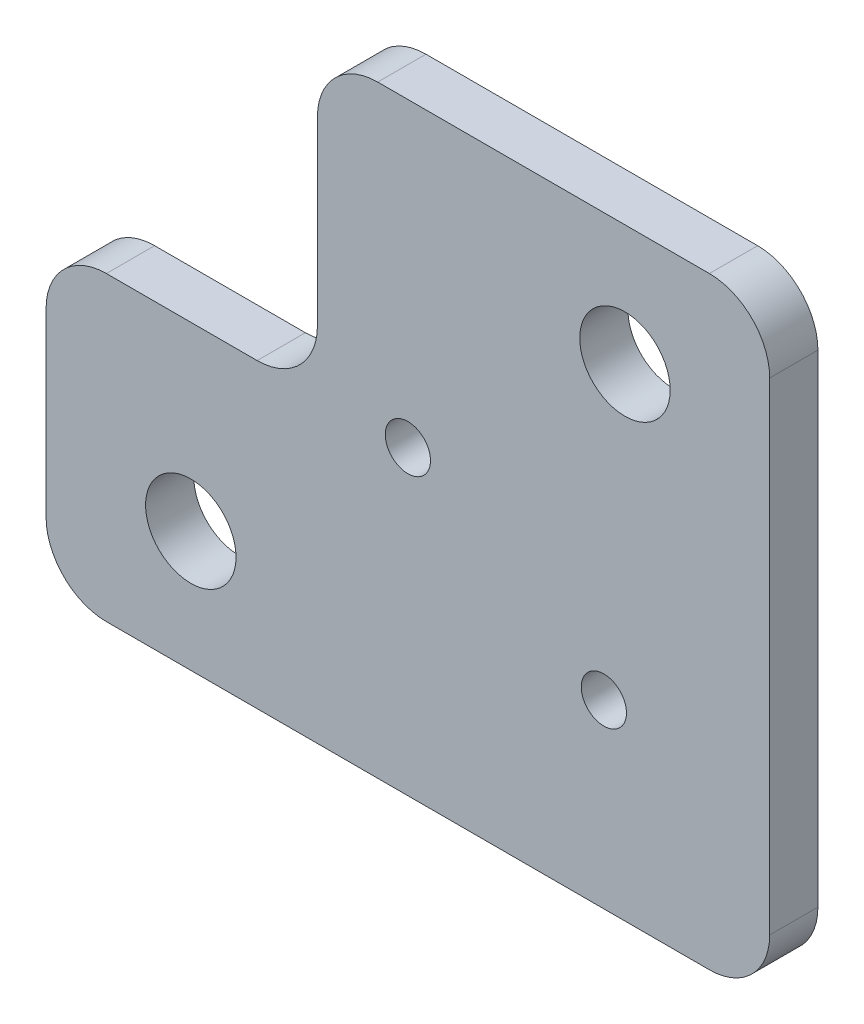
SolidWorks part; units mm, degrees
ref_plane "Спереди" through (0, 0, 0) normal (0, 0, 1) x (1, 0, 0)
ref_plane "Сверху" through (0, 0, 0) normal (0, 1, 0) x (1, 0, 0)
ref_plane "Справа" through (0, 0, 0) normal (1, 0, 0) x (0, 0, -1)
sketch "Эскиз1" plane through (0, 0, 0) normal (0, 0, 1) x (1, 0, 0)
  line L1 (-6, -5) -> (6, -5)
  line L2 (-6, -5) -> (-6, 5)
  line L3 (-6, 5) -> (6, 5)
  line L4 (6, -5) -> (6, 5)
  line L5 (-6, -5) -> (6, 5) construction
  line L6 (-6, 5) -> (6, -5) construction
  point P0 (0, 0)
  dimension "D1" = 12
  dimension "D2" = 10
extrude "Бобышка-Вытянуть1" add sketch "Эскиз1" along normal blind 0.8
sketch "Эскиз2" plane through (0, 0, 0.8) normal (0, 0, 1) x (1, 0, 0)
  line L0 (-6, -5) -> (6, 5) construction
  line L1 (-6, -5) -> (6, -5) construction
  line L3 (-6, 5) -> (-1.5, 5)
  line L4 (6, 5) -> (-6, 5) construction
  line L5 (6, -5) -> (6, 5) construction
  line L6 (-6, 5) -> (-6, 0)
  line L7 (-6, 0) -> (-1.5, 0)
  line L8 (-1.5, 5) -> (-1.5, 0)
  circle A0 centre (0, 0) radius 0.375
  circle A1 centre (-3.6, -3) radius 0.75
  circle A2 centre (3.6, 3) radius 0.75
  circle A3 centre (3.25, -2) radius 0.375
  dimension "D1" = 0.75
  dimension "D3" = 1.5
  dimension "D5" = 1.5
  dimension "D8" = 0.75
  dimension "D2" = 2
  dimension "D4" = 2
  dimension "D6" = 2.75
  dimension "D7" = 3
  dimension "D9" = 7.5
  dimension "D10" = 5
extrude "Вырез-Вытянуть1" cut sketch "Эскиз2" against normal up to next
fillet "Скругление1" radius 1 6 edges at (6, -5, 0.4) (-6, -5, 0.4) (6, 5, 0.4) (-1.5, 5, 0.4) (-1.5, 0, 0.4) (-6, 0, 0.4)
